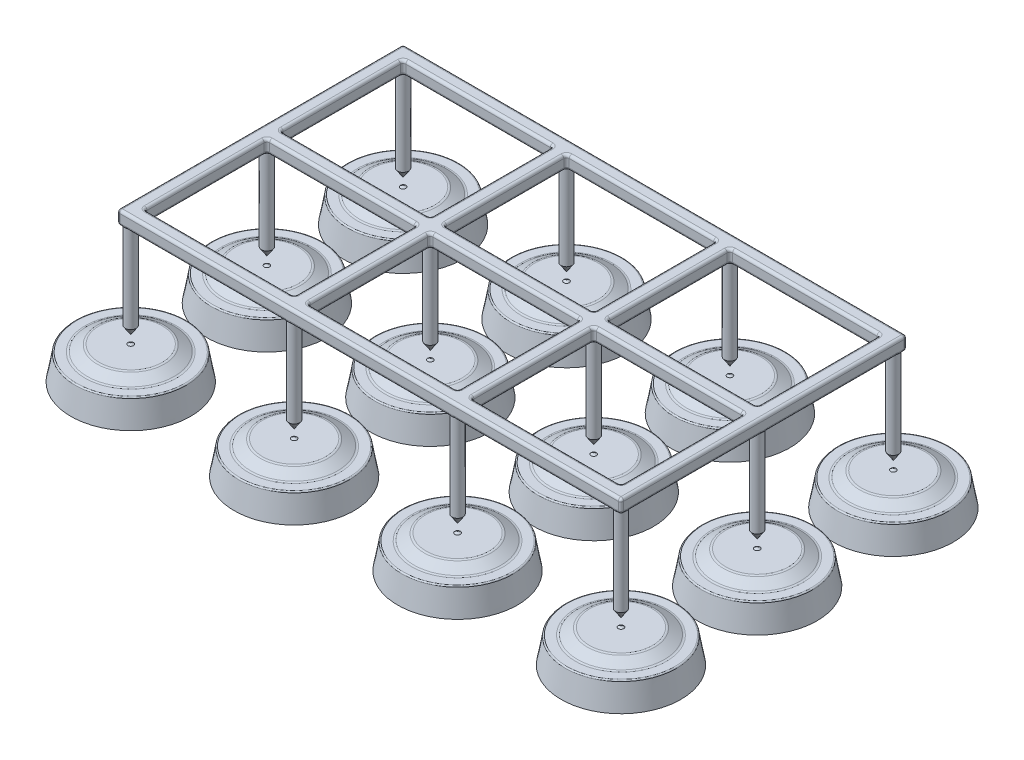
SolidWorks part; units mm, degrees
ref_plane "Front Plane" through (0, 0, 0) normal (0, 0, 1) x (1, 0, 0)
ref_plane "Top Plane" through (0, 0, 0) normal (0, 1, 0) x (1, 0, 0)
ref_plane "Right Plane" through (0, 0, 0) normal (1, 0, 0) x (0, 0, -1)
ref_plane "Plane1" through (0, 55, 0) normal (0, 1, 0) x (1, 0, 0)
sketch "Sketch1" plane through (0, 0, 0) normal (1, 0, 0) x (0, 0, -1)
  line L0 (0, 12) -> (12, 12)
  line L3 (20.3249, 9.5) -> (22, 0)
  line L4 (22, 0) -> (0, 0)
  line L5 (0, 0) -> (0, 12)
  line L6 (12, 12) -> (16.3249, 9.5)
  line L7 (16.3249, 9.5) -> (20.3249, 9.5)
  dimension "D1" = 22
  dimension "D2" = 12
  dimension "D3" = 12
  dimension "D4" = 80
  dimension "D5" = 4
  dimension "D6" = 2.5
revolve "Revolve1" add sketch "Sketch1" angle 360 about L5
fillet "Fillet2" radius 1.5 2 edges at (0, 9.5, -16.3249) (0, 12, -12)
shell "Shell2" thickness 2
fillet "Fillet3" radius 0.5 1 edges at (0, 9.5, -20.3249)
sketch "Sketch3" plane through (0, 12, 0) normal (0, 1, 0) x (1, 0, 0)
  circle A0 centre (0, 0) radius 1
  dimension "D1" = 2
extrude "Boss-Extrude1" add sketch "Sketch3" along normal blind 0.5 draft 60
sketch "Sketch4" plane through (0, 0, 0) normal (0, -1, 0) x (1, 0, 0)
  point P0 (0, 0)
sketch "Sketch5" plane through (0, 0, 0) normal (0, 1, 0) x (1, 0, 0)
  line L1 (0, 0) -> (-180, 0) construction
  line L2 (0, 0) -> (0, 100) construction
  line L3 (0, 100) -> (-180, 100) construction
  line L4 (-180, 0) -> (-180, 100) construction
  point P4 (0, 0)
  point P6 (0.134, 0.991)
  point P7 (0.9313, -0.3643)
  point P9 (0, 0)
  point P11 (0, 0)
  dimension "D1" = 180
  dimension "D2" = 100
sketch "Sketch6" plane through (0, 0, 0) normal (1, 0, 0) x (0, 0, -1)
  line L0 (0, 0) -> (0, 15) construction
  line L1 (0, 15) -> (2, 18)
  line L2 (2, 18) -> (2, 55)
  line L3 (2, 55) -> (0, 55)
  line L4 (0, 55) -> (0, 15)
  dimension "D1" = 15
  dimension "D2" = 40
  dimension "D3" = 2
  dimension "D4" = 3
revolve "Revolve2" add sketch "Sketch6" angle 360 about L0
pattern_linear "LPattern1" count 4 spacing 60 along (-1, 0, 0) count 3 spacing 50 along (0, 0, -1)
sketch "Sketch8" plane through (0, 55, 0) normal (0, 1, 0) x (1, 0, 0)
  line L0 (0, 100) -> (-180, 100)
  line L1 (-180, 100) -> (-180, 0)
  line L2 (-180, 0) -> (0, 0)
  line L3 (0, 0) -> (0, 100)
  line L4 (-180, 50) -> (0, 50)
  line L5 (-120, 100) -> (-120, 0)
  line L6 (-60, 100) -> (-60, 0)
  line L7 (-120, 80.7646) -> (-180, 80.7646) construction
  line L8 (0, 80.7646) -> (-60, 80.7646) construction
  line L9 (-60, 80.7646) -> (-120, 80.7646) construction
  point P18 (0, 0)
extrude "Extrude-Thin1" add sketch "Sketch8" against normal blind 5 thin
fillet "Fillet6" radius 1 84 edges at (-90, 55, 2.5) (-90, 50, 2.5) (-182.5, 55, -50) (-182.5, 50, -50) (-90, 55, -102.5) (-90, 50, -102.5) (2.5, 55, -50) (2.5, 50, -50) (-177.5, 50, -75) (-177.5, 55, -75) (-150, 55, -52.5) (-150, 50, -52.5) (-122.5, 50, -75) (-122.5, 55, -75) (-150, 50, -97.5) (-150, 55, -97.5) (-150, 55, -47.5) (-150, 50, -47.5) (-177.5, 50, -25) (-177.5, 55, -25) (-150, 55, -2.5) (-150, 50, -2.5) (-122.5, 55, -25) (-122.5, 50, -25) (-117.5, 55, -25) (-117.5, 50, -25) (-90, 55, -2.5) (-90, 50, -2.5) (-62.5, 55, -25) (-62.5, 50, -25) (-90, 55, -47.5) (-90, 50, -47.5) (-30, 55, -52.5) (-30, 50, -52.5) (-2.5, 55, -75) (-2.5, 50, -75) (-30, 50, -97.5) (-30, 55, -97.5) (-57.5, 50, -75) (-57.5, 55, -75) (-117.5, 50, -75) (-117.5, 55, -75) (-90, 55, -52.5) (-90, 50, -52.5) (-62.5, 50, -75) (-62.5, 55, -75) (-90, 50, -97.5) (-90, 55, -97.5) (-2.5, 55, -25) (-2.5, 50, -25) (-30, 55, -47.5) (-30, 50, -47.5) (-57.5, 55, -25) (-57.5, 50, -25) (-30, 55, -2.5) (-30, 50, -2.5) (-57.5, 52.5, -52.5) (-57.5, 52.5, -47.5) (-57.5, 52.5, -97.5) (-57.5, 52.5, -2.5) (-62.5, 52.5, -52.5) (-62.5, 52.5, -47.5) (-62.5, 52.5, -97.5) (-62.5, 52.5, -2.5) (-117.5, 52.5, -47.5) (-117.5, 52.5, -97.5) (-117.5, 52.5, -2.5) (-122.5, 52.5, -47.5) (-122.5, 52.5, -97.5) (-122.5, 52.5, -2.5) (-177.5, 52.5, -52.5) (-2.5, 52.5, -52.5) (-177.5, 52.5, -47.5) (-2.5, 52.5, -47.5) (-2.5, 52.5, -97.5) (-177.5, 52.5, -97.5) (-177.5, 52.5, -2.5) (-2.5, 52.5, -2.5) (2.5, 52.5, -102.5) (-182.5, 52.5, -102.5) (-182.5, 52.5, 2.5) (-117.5, 52.5, -52.5) (-122.5, 52.5, -52.5) (2.5, 52.5, 2.5)
